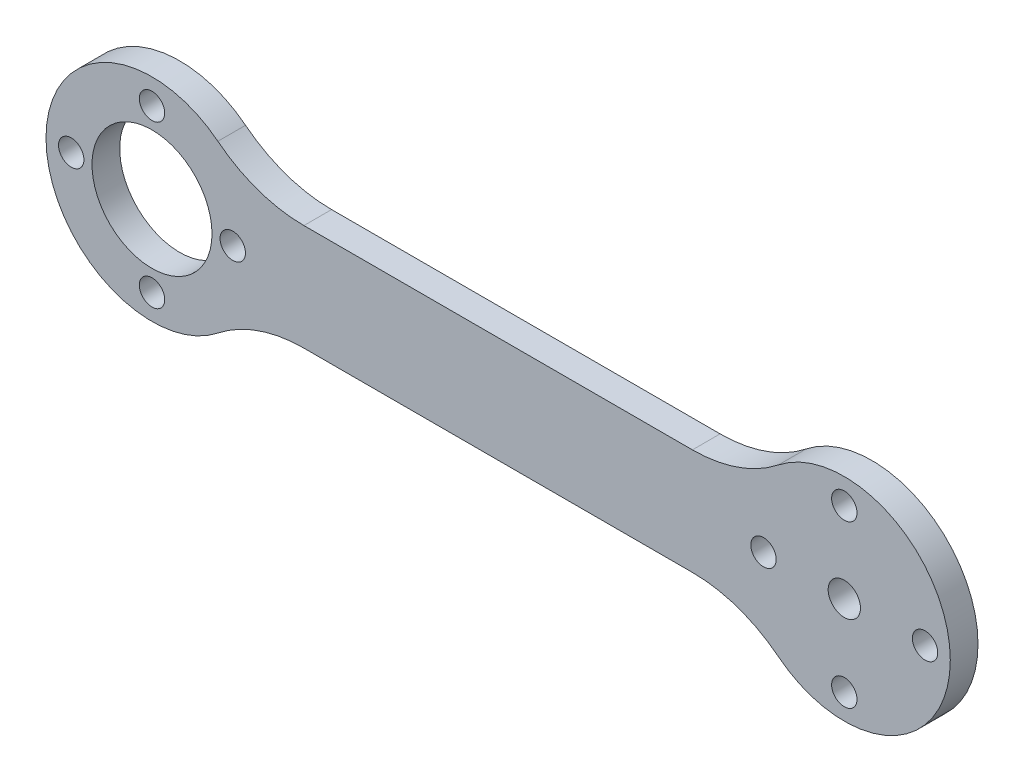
SolidWorks part; units mm, degrees
ref_plane "Front Plane" through (0, 0, 0) normal (0, 0, 1) x (1, 0, 0)
ref_plane "Top Plane" through (0, 0, 0) normal (0, 1, 0) x (1, 0, 0)
ref_plane "Right Plane" through (0, 0, 0) normal (1, 0, 0) x (0, 0, -1)
sketch "Sketch1" plane through (0, 0, 0) normal (0, 0, 1) x (1, 0, 0)
  line L0 (0, -1000) -> (0, 49000) construction
  line L2 (-79.6051, 22.5) -> (-79.6051, -41.3952) construction
  line L4 (-52.5, 39.4063) -> (-52.5, -39.4063) construction
  line L5 (-86.0672, 17.9566) -> (88.6229, -18.4898) construction
  line L6 (-85.3405, -20.0502) -> (85.943, 20.1918) construction
  line L7 (-1000, 0) -> (49000, 0) construction
  line L8 (79.6051, 22.5) -> (79.6051, -28.8129) construction
  line L9 (52.5, 40.724) -> (52.5, -40.724) construction
  line L11 (-42.0881, 11.5) -> (42.0881, 11.5)
  line L13 (-42.0881, -11.5) -> (42.0881, -11.5)
  line L15 (-55.1202, 11.5) -> (55.1202, -11.5) construction
  line L16 (-55.1202, -11.5) -> (55.1202, 11.5) construction
  arc A0 (60.7293, 17.9945) -> (79.6051, 22.5) centre (75, 0) cw
  circle A1 centre (-75, 0) radius 13
  circle A2 centre (-75, 0) radius 17.5 construction
  circle A3 centre (-75, 17.5) radius 2.75
  circle A4 centre (-57.5, 0) radius 2.75
  circle A5 centre (-75, -17.5) radius 2.75
  circle A6 centre (-92.5, 0) radius 2.75
  circle A7 centre (57.5, 0) radius 2.75
  circle A8 centre (75, -17.5) radius 2.75
  circle A9 centre (92.5, 0) radius 2.75
  circle A10 centre (75, 17.5) radius 2.75
  arc A11 (79.6051, 22.5) -> (97.9664, 0) centre (75, 0) cw
  circle A12 centre (75, 0) radius 3.5
  circle A13 centre (75, 0) radius 17.5 construction
  arc A14 (-60.7293, 17.9945) -> (-60.7293, -17.9945) centre (-75, 0) ccw
  arc A15 (97.9664, 0) -> (88.6229, -18.4898) centre (75, 0) cw
  arc A16 (88.6229, -18.4898) -> (79.6051, -22.5) centre (75, 0) cw
  arc A17 (79.6051, -22.5) -> (60.7293, -17.9945) centre (75, 0) cw
  arc A18 (-60.7293, -17.9945) -> (-42.0881, -11.5) centre (-42.0881, -41.5) cw
  arc A19 (-42.0881, 11.5) -> (-60.7293, 17.9945) centre (-42.0881, 41.5) cw
  arc A20 (42.0881, 11.5) -> (60.7293, 17.9945) centre (42.0881, 41.5) ccw
  arc A21 (42.0881, -11.5) -> (60.7293, -17.9945) centre (42.0881, -41.5) cw
  point P0 (0, 0)
  point P27 (-75, 0)
  point P41 (0, 0)
  point P44 (-52.5, 0)
  point P47 (52.5, 0)
  dimension "D3" = 45
  dimension "D1" = 35
  dimension "D2" = 26
  dimension "D4" = 5.5
  dimension "D6" = 7
  dimension "D9" = 30
  dimension "D7" = 150
  dimension "D8" = 23
  dimension "D5" = 4
extrude "Boss-Extrude1" add sketch "Sketch1" along normal blind 6
